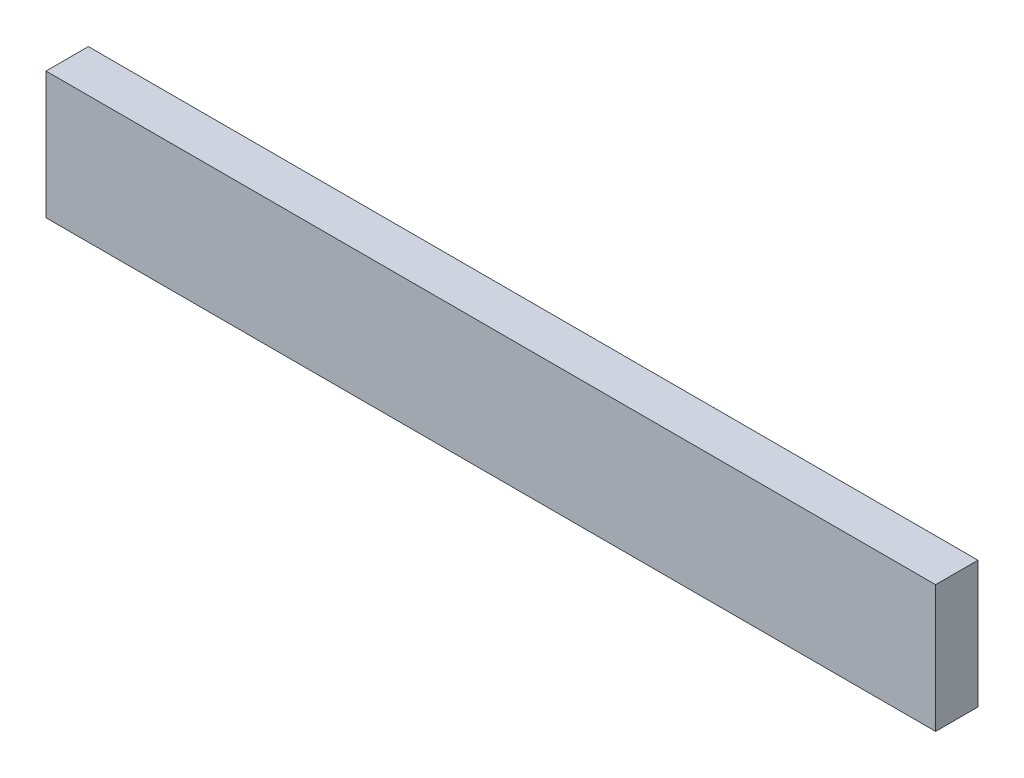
SolidWorks part; units mm, degrees
ref_plane "Front Plane" through (0, 0, 0) normal (0, 0, 1) x (1, 0, 0)
ref_plane "Top Plane" through (0, 0, 0) normal (0, 1, 0) x (1, 0, 0)
ref_plane "Right Plane" through (0, 0, 0) normal (1, 0, 0) x (0, 0, -1)
sketch "Sketch1" plane through (0, 0, 0) normal (0, 0, 1) x (1, 0, 0)
  line L1 (-31.5, -4.5) -> (31.5, -4.5)
  line L2 (-31.5, -4.5) -> (-31.5, 4.5)
  line L3 (-31.5, 4.5) -> (31.5, 4.5)
  line L4 (31.5, -4.5) -> (31.5, 4.5)
  line L5 (-31.5, -4.5) -> (31.5, 4.5) construction
  line L6 (-31.5, 4.5) -> (31.5, -4.5) construction
  point P0 (0, 0)
  dimension "D1" = 63
  dimension "D2" = 9
extrude "Boss-Extrude1" add sketch "Sketch1" along normal blind 3
